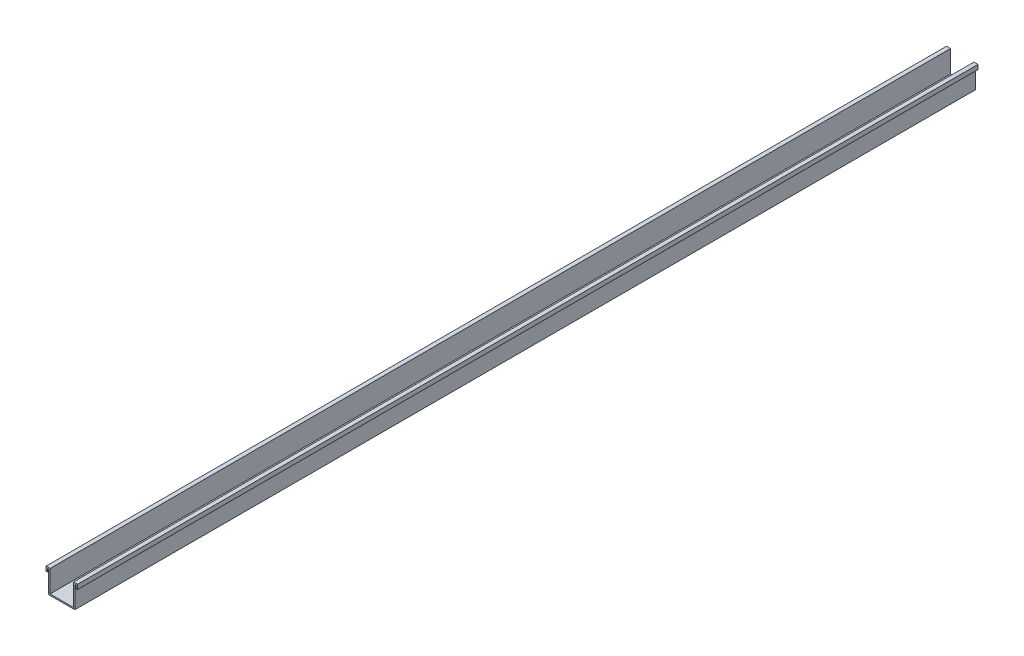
SolidWorks part; units mm, degrees
ref_plane "Front Plane" through (0, 0, 0) normal (0, 0, 1) x (1, 0, 0)
ref_plane "Top Plane" through (0, 0, 0) normal (0, 1, 0) x (1, 0, 0)
ref_plane "Right Plane" through (0, 0, 0) normal (1, 0, 0) x (0, 0, -1)
sketch "Sketch1" plane through (0, 0, 0) normal (0, 0, 1) x (1, 0, 0)
  line L32 (-16, 24.5) -> (-14.5, 24.5)
  line L33 (-14.5, 24.5) -> (-14.5, 0)
  line L34 (-14.5, 0) -> (14.5, 0)
  line L35 (14.5, 0) -> (14.5, 24.5)
  line L36 (14.5, 24.5) -> (16, 24.5)
  line L37 (16, 24.5) -> (16, 21)
  line L38 (16, 21) -> (17.5, 21)
  line L39 (17.5, 21) -> (17.5, 26)
  line L40 (17.5, 26) -> (13, 26)
  line L41 (13, 26) -> (13, 1.5)
  line L42 (13, 1.5) -> (-13, 1.5)
  line L43 (-13, 1.5) -> (-13, 26)
  line L44 (-13, 26) -> (-17.5, 26)
  line L45 (-17.5, 26) -> (-17.5, 21)
  line L46 (-17.5, 21) -> (-16, 21)
  line L47 (-16, 21) -> (-16, 24.5)
extrude "Boss-Extrude1" add sketch "Sketch1" along normal blind 1000 contours L33 L34 L35 L36 L37 L38 L39 L40 L41 L42 L43 L44 L45 L46 L47 L32
